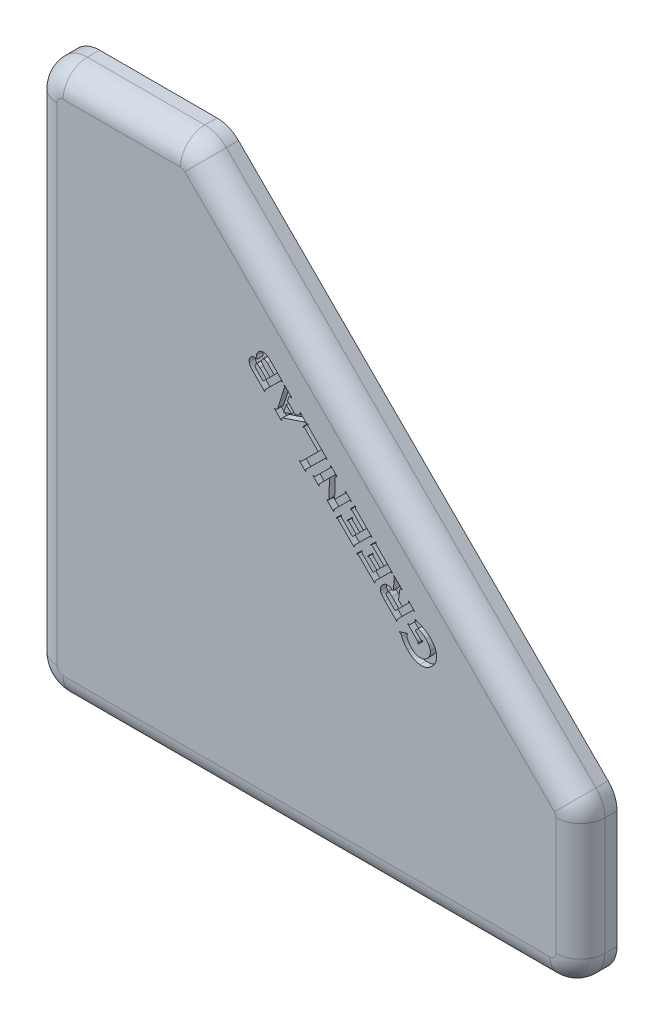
SolidWorks part; units mm, degrees
ref_plane "Front Plane" through (0, 0, 0) normal (0, 0, 1) x (1, 0, 0)
ref_plane "Top Plane" through (0, 0, 0) normal (0, 1, 0) x (1, 0, 0)
ref_plane "Right Plane" through (0, 0, 0) normal (1, 0, 0) x (0, 0, -1)
ref_plane "Plane1" through (0, 0, 3) normal (0, 0, 1) x (1, 0, 0)
sketch "Sketch1" plane through (0, 0, 3) normal (0, 0, 1) x (1, 0, 0)
  line L0 (-9.3202, 22.5) -> (-22.5002, 22.5)
  line L1 (-22.5002, 22.5) -> (-22.5002, -22.5)
  line L2 (-22.5002, -22.5) -> (22.4998, -22.5)
  line L3 (22.4998, -22.5) -> (22.4998, -9.32)
  line L4 (22.4998, -9.32) -> (-9.3202, 22.5)
  dimension "D1" = 13.18
  dimension "D2" = 45
  dimension "D3" = 13.18
  dimension "D4" = 45
extrude "Boss-Extrude1" add sketch "Sketch1" against normal blind 3
fillet "Fillet1" radius 2.5 5 edges at (22.4998, -9.32, 1.5) (22.4998, -22.5, 1.5) (-9.3202, 22.5, 1.5) (-22.5002, 22.5, 1.5) (-22.5002, -22.5, 1.5)
fillet "Fillet2" radius 2 10 edges at (-0.0002, -22.5, 3) (-21.7679, -21.7678, 3) (21.7676, -21.7678, 3) (-22.5002, 0, 3) (22.4998, -15.1778, 3) (-21.7679, 21.7678, 3) (22.3095, -9.3988, 3) (-15.1779, 22.5, 3) (6.5898, 6.59, 3) (-9.399, 22.3097, 3)
sketch "Sketch2" plane through (0, 0, 3) normal (0, 0, 1) x (1, 0, 0)
  line L0 (20.4998, -10.3555) -> (-10.0021, 20.3536) construction
  line L1 (5.2489, 4.999) -> (35480.0123, 35240.509) construction
  line L2 (-11.9452, 19.4717) -> (19.6049, -12.2926) construction
  text T0 "GreenLab" font "Copperplate Gothic Bold" height 2.5
  point P6 (5.2489, 4.999)
  point P10 (3.8299, 3.5896)
  dimension "D1" = 2
extrude "Cut-Extrude1" cut sketch "Sketch2" against normal blind 0.5
